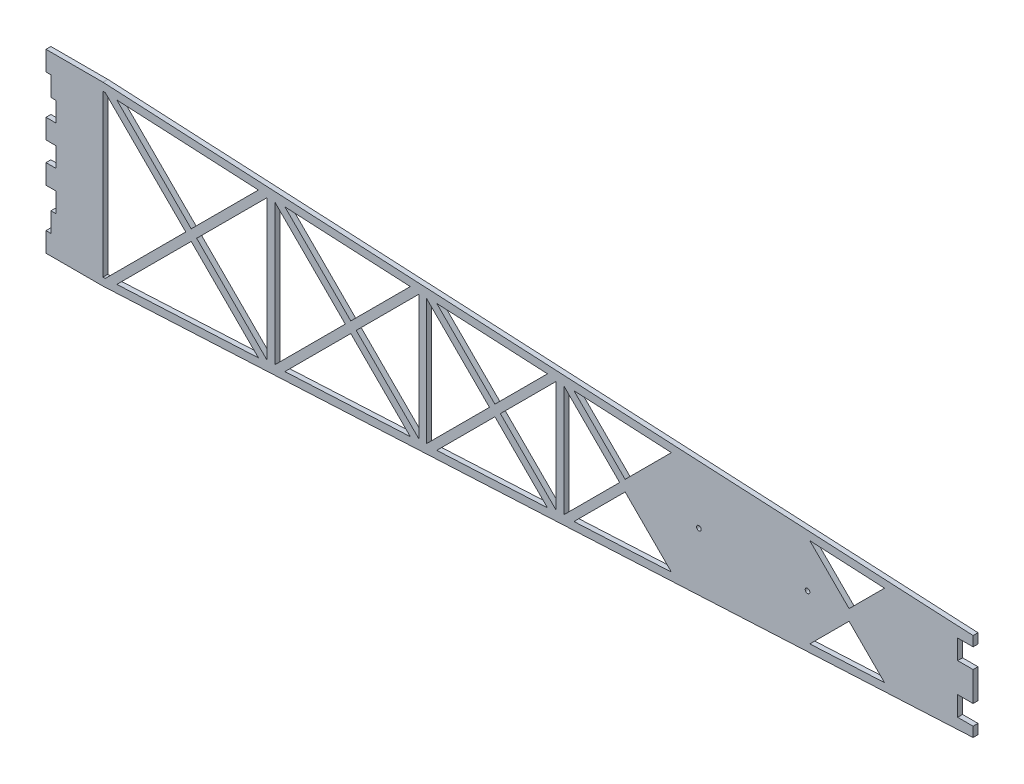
SolidWorks part; units mm, degrees
ref_plane "Front Plane" through (0, 0, 0) normal (0, 0, 1) x (1, 0, 0)
ref_plane "Top Plane" through (0, 0, 0) normal (0, 1, 0) x (1, 0, 0)
ref_plane "Right Plane" through (0, 0, 0) normal (1, 0, 0) x (0, 0, -1)
sketch "Sketch1" plane through (0, 0, 0) normal (0, 0, 1) x (1, 0, 0)
  line L0 (0, 0) -> (0, 114.3)
  line L1 (0, 0) -> (50000, 0) construction
  line L2 (0, 0) -> (36.83, 0)
  line L3 (0, 57.15) -> (600, 57.15) construction
  line L4 (600, 28.575) -> (600, 85.725)
  line L5 (36.83, 0) -> (600, 28.575)
  line L6 (36.83, 114.3) -> (600, 85.725)
  line L7 (0, 114.3) -> (36.83, 114.3)
  line L8 (0, 12.7) -> (3.175, 12.7)
  line L9 (3.175, 12.7) -> (3.175, 25.4)
  line L10 (3.175, 25.4) -> (4.765, 25.4)
  line L11 (4.765, 25.4) -> (4.765, 38.1)
  line L12 (4.765, 38.1) -> (0, 38.1)
  line L13 (0, 38.1) -> (0, 50.8)
  line L14 (0, 50.8) -> (6.5901, 50.8)
  line L15 (6.5901, 50.8) -> (6.5901, 63.5)
  line L16 (0, 101.6) -> (3.175, 101.6)
  line L17 (3.175, 101.6) -> (3.175, 88.9)
  line L18 (3.175, 88.9) -> (4.765, 88.9)
  line L19 (4.765, 88.9) -> (4.765, 76.2)
  line L20 (4.765, 76.2) -> (0, 76.2)
  line L21 (0, 63.5) -> (6.5901, 63.5)
  line L22 (0, 63.5) -> (0, 50.8)
  line L23 (0, 101.6) -> (0, 76.2)
  line L24 (0, 38.1) -> (0, 12.7)
  point P28 (6.5901, 57.15)
  dimension "D1" = 600
  dimension "D2" = 57.15
  dimension "D3" = 36.83
  dimension "D4" = 36.83
  dimension "D5" = 57.15
  dimension "D6" = 2.905
  dimension "D7" = 3.175
  dimension "D8" = 12.7
  dimension "D9" = 12.7
  dimension "D10" = 12.7
  dimension "D11" = 1.59
  dimension "D12" = 12.7
  dimension "D13" = 6.35
  dimension "D14" = 12.7
  dimension "D15" = 6.5901
extrude "Boss-Extrude1" add sketch "Sketch1" against normal blind 3.175 contours L0 L21 L15 L14 L12 L11 L10 L9 L8 L2 L5 L4 L6 L7 L16 L17 L18 L19 L20
sketch "Sketch4" plane through (0, 0, 0) normal (0, 0, 1) x (1, 0, 0)
  line L0 (36.83, 114.3) -> (36.83, 0) construction
  line L1 (36.83, 0) -> (145.6105, 108.7805) construction
  line L2 (36.83, 114.3) -> (600, 85.725) construction
  line L3 (145.6105, 108.7805) -> (243.8852, 10.5059) construction
  line L4 (36.83, 0) -> (600, 28.575) construction
  line L5 (243.8852, 10.5059) -> (332.6686, 99.2893) construction
  line L6 (332.6686, 99.2893) -> (411.1096, 20.8482) construction
  line L7 (412.8774, 19.0805) -> (485.3397, 91.5428) construction
  line L8 (485.3397, 91.5428) -> (550.8037, 26.0788) construction
  line L9 (36.83, 114.3) -> (145.6105, 5.5195) construction
  line L10 (145.6105, 5.5195) -> (145.6105, 108.7805) construction
  line L11 (145.6105, 5.5195) -> (243.8852, 103.7941) construction
  line L12 (243.8852, 103.7941) -> (332.6686, 15.0107) construction
  line L13 (332.6686, 15.0107) -> (412.8774, 95.2195) construction
  line L14 (412.8774, 95.2195) -> (485.3397, 22.7572) construction
  line L15 (485.3397, 22.7572) -> (550.8037, 88.2212) construction
  line L16 (243.8852, 103.7941) -> (243.8852, 10.5059) construction
  line L17 (332.6686, 99.2893) -> (332.6686, 15.0107) construction
  line L18 (412.8774, 95.2195) -> (412.8774, 19.0805) construction
  line L19 (485.3397, 91.5428) -> (485.3397, 20.9866) construction
  line L20 (550.8037, 88.2212) -> (550.8037, 26.0788) construction
  line L21 (331.2687, 19.9461) -> (404.7479, 23.6744)
  line L22 (330.1686, 93.2537) -> (330.1686, 21.0463)
  line L23 (242.1174, 12.2737) -> (330.9008, 101.057) construction
  line L24 (335.1686, 93.2537) -> (335.1686, 15.0107) construction
  line L25 (330.1686, 105.3248) -> (410.3774, 25.116) construction
  line L26 (245.6529, 8.7381) -> (334.4363, 97.5215) construction
  line L27 (36.5766, 4.9936) -> (599.7466, 33.5686)
  line L28 (36.5766, 4.9936) -> (324.5391, 19.6047)
  line L29 (38.5978, 116.0678) -> (147.3783, 7.2872)
  line L30 (36.5766, 109.3064) -> (599.7466, 80.7314)
  line L31 (36.5766, 109.3064) -> (324.5391, 94.6953)
  line L32 (35.0622, 1.7678) -> (143.8428, 110.5483)
  line L33 (147.3783, 110.5483) -> (245.6529, 12.2737)
  line L34 (143.8428, 7.2872) -> (242.1174, 105.5619)
  line L35 (245.6529, 105.5619) -> (330.1686, 21.0463)
  line L36 (246.3852, 103.7941) -> (246.3852, 10.5059)
  line L37 (143.1105, 5.5195) -> (143.1105, 108.7805)
  line L38 (242.1174, 12.2737) -> (324.5391, 94.6953)
  line L39 (35.0622, 112.5322) -> (143.8428, 3.7517)
  line L40 (38.5978, -1.7678) -> (147.3783, 107.0128)
  line L41 (143.8428, 107.0128) -> (242.1174, 8.7381)
  line L42 (147.3783, 3.7517) -> (245.6529, 102.0263)
  line L43 (242.1174, 102.0263) -> (324.5391, 19.6047)
  line L44 (241.3852, 103.7941) -> (241.3852, 10.5059)
  line L45 (148.1105, 5.5195) -> (148.1105, 108.7805)
  line L46 (245.6529, 8.7381) -> (330.1686, 93.2537)
  line L47 (410.3774, 89.184) -> (410.3774, 25.116)
  line L48 (341.6671, 93.8263) -> (410.3774, 25.116)
  line L49 (341.6671, 93.8263) -> (404.7479, 90.6256)
  line L50 (415.3774, 89.184) -> (415.3774, 25.116)
  line L51 (335.1686, 93.2537) -> (404.7479, 23.6744)
  line L52 (335.1686, 93.2537) -> (335.1686, 20.144)
  line L53 (341.6671, 20.4737) -> (410.3774, 89.184)
  line L54 (415.3774, 89.184) -> (477.2102, 27.3511)
  line L55 (421.8759, 24.5435) -> (482.8397, 85.5073)
  line L56 (36.83, 114.3) -> (600, 85.725)
  line L57 (553.3037, 31.2121) -> (599.7466, 33.5686)
  line L58 (487.8397, 85.5073) -> (542.6742, 30.6727)
  line L59 (332.6686, 18.5463) -> (404.7479, 90.6256)
  line L60 (421.8759, 89.7565) -> (482.8397, 28.7927)
  line L61 (242.1174, 102.0263) -> (330.9008, 13.243) construction
  line L62 (415.3774, 25.116) -> (477.2102, 86.9489)
  line L63 (487.1075, 93.3106) -> (552.5715, 27.8466) construction
  line L64 (494.3382, 86.0798) -> (548.3037, 32.1143)
  line L65 (553.3037, 83.0879) -> (599.7466, 80.7314)
  line L66 (553.3037, 83.0879) -> (553.3037, 31.2121)
  line L67 (421.8759, 89.7565) -> (477.2102, 86.9489)
  line L68 (330.9008, 16.7785) -> (412.8774, 98.7551) construction
  line L69 (410.3774, 95.2195) -> (410.3774, 25.116) construction
  line L70 (334.4363, 13.243) -> (412.8774, 91.684) construction
  line L71 (412.8774, 91.684) -> (485.3397, 19.2217) construction
  line L72 (412.8774, 98.7551) -> (485.3397, 26.2927) construction
  line L73 (415.3774, 95.2195) -> (415.3774, 13.0449) construction
  line L74 (482.8397, 85.5073) -> (482.8397, 28.7927)
  line L75 (411.1096, 20.8482) -> (483.5719, 93.3106) construction
  line L76 (483.5719, 89.775) -> (549.0359, 24.311) construction
  line L77 (494.3382, 86.0798) -> (542.6742, 83.6273)
  line L78 (245.6529, 105.5619) -> (334.4363, 16.7785) construction
  line L79 (487.8397, 85.5073) -> (487.8397, 28.7927)
  line L80 (485.3397, 26.2927) -> (549.0359, 89.989) construction
  line L81 (548.3037, 82.1857) -> (548.3037, 32.1143)
  line L82 (553.3037, 88.2212) -> (553.3037, 26.0788) construction
  line L83 (485.3397, 19.2217) -> (552.5715, 86.4534) construction
  line L84 (335.1686, 93.2537) -> (415.3774, 13.0449) construction
  line L85 (494.3382, 28.2202) -> (542.6742, 30.6727)
  line L86 (494.3382, 28.2202) -> (548.3037, 82.1857)
  line L87 (487.8397, 28.7927) -> (542.6742, 83.6273)
  line L88 (332.6686, 99.2893) -> (412.8774, 19.0805) construction
  line L89 (421.8759, 24.5435) -> (477.2102, 27.3511)
  line L90 (330.1686, 105.3248) -> (330.1686, 15.0107) construction
  line L91 (36.83, 0) -> (600, 28.575)
  line L92 (36.83, 114.3) -> (36.83, -0.5269)
  point P69 (414.6451, 17.3127)
  point P70 (487.1075, 89.775)
  point P71 (482.8397, 91.5428)
  point P72 (482.8397, 20.9866)
  point P81 (487.8397, 91.5428)
  point P82 (487.8397, 20.9866)
  point P85 (548.3037, 88.2212)
  point P86 (548.3037, 26.0788)
  dimension "D1" = 5
  dimension "D2" = 5
  dimension "D3" = 2.5
  dimension "D4" = 2.5
  dimension "D5" = 2.5
  dimension "D6" = 2.5
  dimension "D7" = 2.5
  dimension "D8" = 2.5
  dimension "D10" = 2.5
extrude "Cut-Extrude1" cut sketch "Sketch4" against normal through all both and the other way through all contours L31 L92 L28 L32 L39 | L29 L32 L31 | L40 L28 L39 | L40 L29 L37 | L45 L34 L41 | L42 L28 L41 | L33 L34 L31 | L44 L42 L33 | L43 L36 L38 | L35 L38 L31 | L46 L28 L43 | L46 L35 L22 | L52 L59 L51 | L48 L59 L49 | L53 L21 L51 | L64 L87 L77 | L86 L85 L58
sketch "Sketch5" plane through (0, 0, 0) normal (0, 0, 1) x (1, 0, 0)
  line L0 (600, 57.15) -> (516.197, 57.15) construction
  line L1 (600, 28.575) -> (600, 85.725) construction
  line L3 (600, 47.625) -> (590, 47.625)
  line L4 (590, 47.625) -> (590, 34.925)
  line L5 (590, 34.925) -> (600, 34.925)
  line L6 (600, 66.675) -> (590, 66.675)
  line L7 (590, 79.375) -> (600, 79.375)
  line L8 (590, 66.675) -> (590, 79.375)
  line L9 (600, 28.575) -> (600, 85.725)
  line L10 (519.7325, 60.6855) -> (542.6742, 83.6273) construction
  dimension "D1" = 10
  dimension "D2" = 12.7
  dimension "D3" = 6.35
extrude "Cut-Extrude2" cut sketch "Sketch5" against normal through all both and the other way through all contours L6 L9 L7 L8 | L5 L9 L3 L4
sketch "Sketch6" plane through (0, 0, 0) normal (0, 0, 1) x (1, 0, 0)
  line L0 (600, 57.15) -> (387.8515, 57.15) construction
  line L1 (600, 47.625) -> (600, 66.675) construction
  circle A0 centre (422.53, 57.15) radius 1.5
  circle A1 centre (492.8319, 57.15) radius 1.5
  dimension "D1" = 3
  dimension "D2" = 3
  dimension "D3" = 177.47
  dimension "D4" = 70.3019
extrude "Cut-Extrude3" cut sketch "Sketch6" against normal through all both and the other way through all
sketch "Sketch7" plane through (0, 0, 0) normal (0, 0, 1) x (1, 0, 0)
  line L0 (3.175, 88.9) -> (6.5901, 88.9)
  line L1 (6.5901, 88.9) -> (6.5901, 76.2)
  line L2 (6.5901, 76.2) -> (0, 76.2)
  line L3 (0, 101.6) -> (0, 114.3) construction
  line L4 (0, 38.1) -> (6.5901, 38.1)
  line L5 (6.5901, 38.1) -> (6.5901, 25.4)
  line L6 (6.5901, 25.4) -> (3.175, 25.4)
  line L7 (3.175, 25.4) -> (-1.0711, 25.4)
  line L8 (-1.0711, 25.4) -> (0, 38.1)
  line L9 (0, 76.2) -> (3.175, 88.9)
  dimension "D1" = 6.5901
  dimension "D2" = 6.5901
extrude "Cut-Extrude4" cut sketch "Sketch7" against normal through all both and the other way through all
